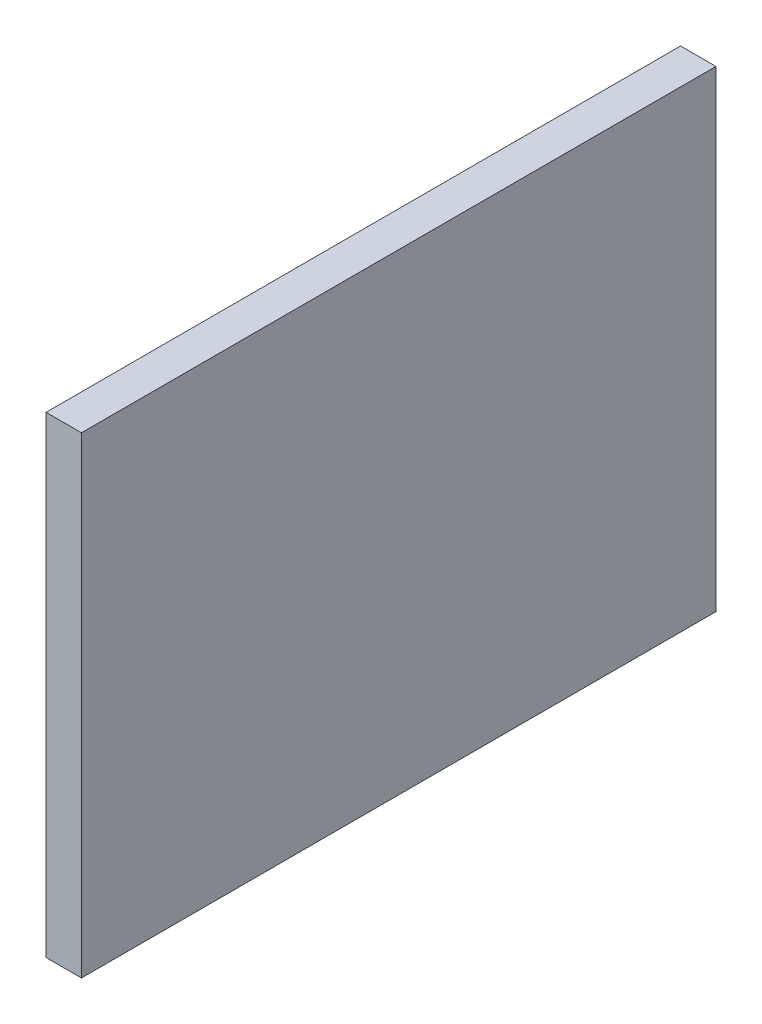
SolidWorks part; units mm, degrees
ref_plane "Plan de face" through (0, 0, 0) normal (0, 0, 1) x (1, 0, 0)
ref_plane "Plan de dessus" through (0, 0, 0) normal (0, 1, 0) x (1, 0, 0)
ref_plane "Plan de droite" through (0, 0, 0) normal (1, 0, 0) x (0, 0, -1)
sketch "Esquisse1" plane through (0, 0, 0) normal (0, 0, 1) x (1, 0, 0)
  line L1 (0, 0) -> (12, 0)
  line L2 (0, 0) -> (0, 160)
  line L3 (0, 160) -> (12, 160)
  line L4 (12, 0) -> (12, 160)
  dimension "D1" = 160
  dimension "D2" = 12
extrude "Extrusion1" add sketch "Esquisse1" along normal blind 215
